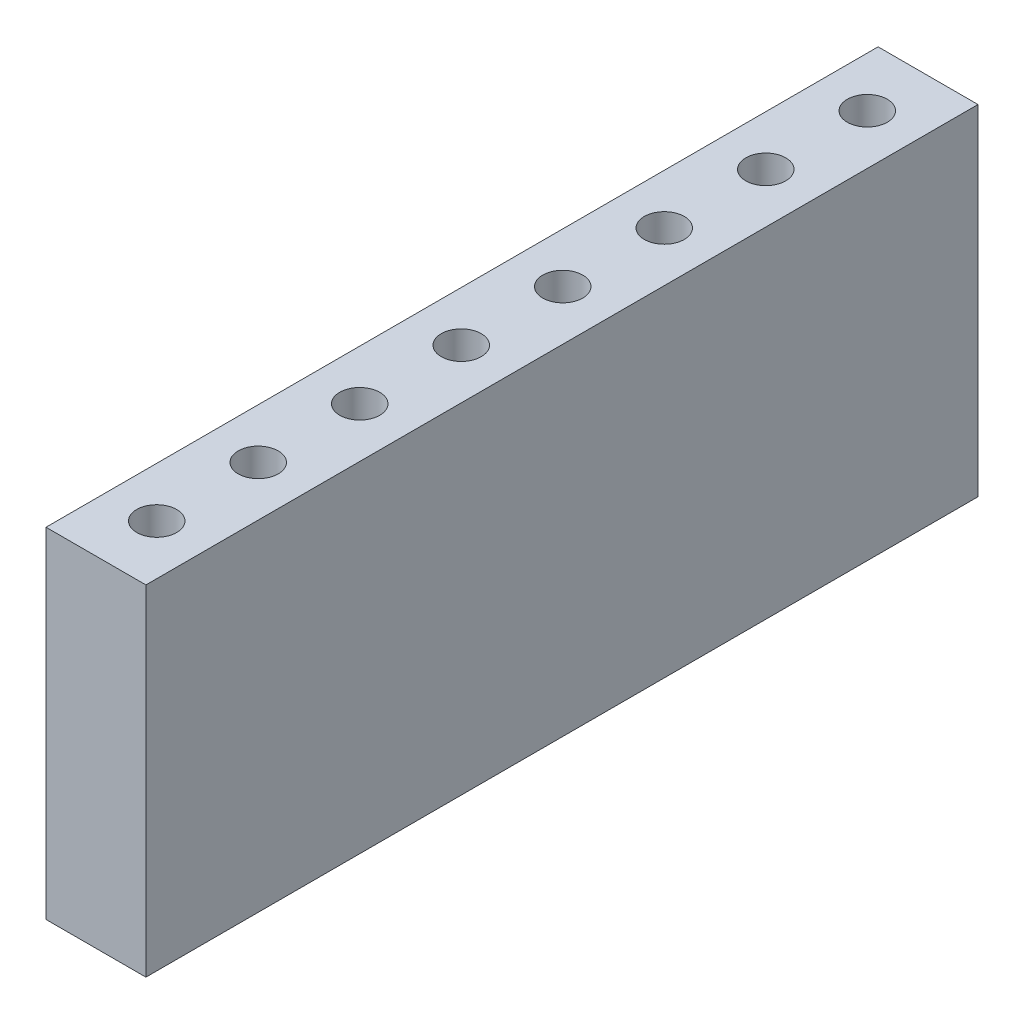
SolidWorks part; units mm, degrees
ref_plane "Front Plane" through (0, 0, 0) normal (0, 0, 1) x (1, 0, 0)
ref_plane "Top Plane" through (0, 0, 0) normal (0, 1, 0) x (1, 0, 0)
ref_plane "Right Plane" through (0, 0, 0) normal (1, 0, 0) x (0, 0, -1)
sketch "Sketch1" plane through (0, 0, 0) normal (0, 1, 0) x (1, 0, 0)
  line L0 (1.25, 20.82) -> (1.25, 0) construction
  line L1 (0, 0) -> (2.5, 0)
  line L2 (0, 0) -> (0, 20.82)
  line L3 (0, 20.82) -> (2.5, 20.82)
  line L4 (2.5, 0) -> (2.5, 20.82)
  line L5 (0, 10.41) -> (2.5, 10.41) construction
  dimension "D1" = 20.82
  dimension "D2" = 2.5
extrude "Extrude1" add sketch "Sketch1" along normal blind 8.5
sketch "Sketch2" plane through (0, 8.5, 0) normal (0, 1, 0) x (-1, 0, 0)
  line L0 (-1.25, 0) -> (-1.25, -20.82) construction
  line L1 (0, 0) -> (-2.5, 0) construction
  line L2 (-2.5, -20.82) -> (0, -20.82) construction
  line L3 (-2.5, -10.41) -> (0, -10.41) construction
  line L4 (-2.5, 0) -> (-2.5, -20.82) construction
  line L5 (0, -20.82) -> (0, 0) construction
  circle A0 centre (-1.25, -9.14) radius 0.5
  circle A1 centre (-1.25, -6.6) radius 0.5
  circle A2 centre (-1.25, -4.06) radius 0.5
  circle A3 centre (-1.25, -1.52) radius 0.5
  circle A4 centre (-1.25, -19.3) radius 0.5
  circle A5 centre (-1.25, -16.76) radius 0.5
  circle A6 centre (-1.25, -14.22) radius 0.5
  circle A7 centre (-1.25, -11.68) radius 0.5
  dimension "D1" = 1
  dimension "D2" = 2.54
  dimension "D3" = 2.54
extrude "Cut-Extrude1" cut sketch "Sketch2" against normal blind 6.38
sketch "Sketch3" plane through (0, 0, 0) normal (0, -1, 0) x (1, 0, 0)
  circle A0 centre (1.25, -1.52) radius 0.5 construction
  point P0 (1.25, -1.52)
